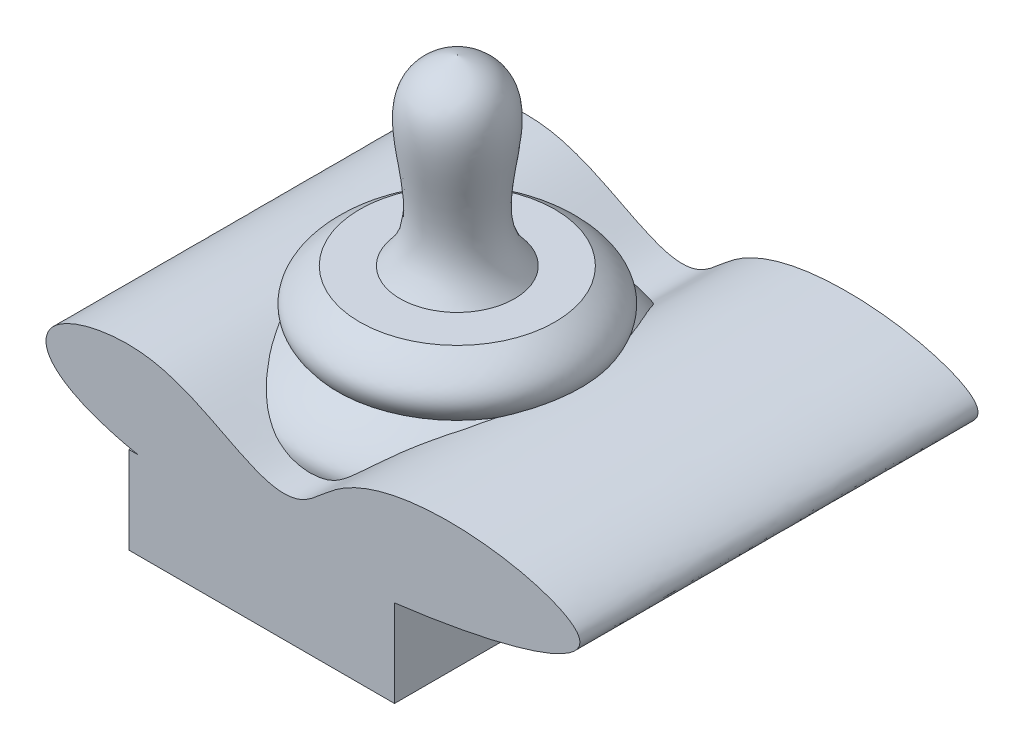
SolidWorks part; units mm, degrees
ref_plane "Front Plane" through (0, 0, 0) normal (0, 0, 1) x (1, 0, 0)
ref_plane "Top Plane" through (0, 0, 0) normal (0, 1, 0) x (1, 0, 0)
ref_plane "Right Plane" through (0, 0, 0) normal (1, 0, 0) x (0, 0, -1)
sketch "Sketch1" plane through (0, 0, 0) normal (0, 0, 1) x (1, 0, 0)
  line L0 (0, 0) -> (0, -54.3886) construction
  line L1 (0, 0) -> (31.766, 0)
  line L2 (0, 0) -> (0, -54.3886)
  spline S0 degree 3 poles (31.766, 0) (55.0699, -14.2399) (21.5753, -21.9397) (12.8614, -50.5304) (21.5731, -74.2423) (0, -54.3886) knots 0 0 0 0 0.481937 0.627515 1 1 1 1
revolve "Revolve1" add sketch "Sketch1" about L0
sketch "Sketch2" plane through (0, 0, 0) normal (0, 0, 1) x (1, 0, 0)
  line L0 (0, -46.5393) -> (0, 59.3095) construction
  line L1 (0, -46.5393) -> (27.7373, -46.5393)
  line L2 (0, -46.5393) -> (0, 59.3095)
  spline S0 degree 3 poles (27.7373, -46.5393) (83.9406, -25.5091) (-21.0612, -11.1362) (27.6229, 52.6904) (0, 59.3095) knots 0 0 0 0 0.579051 1 1 1 1
revolve "Revolve2" add sketch "Sketch2" about L0
sketch "Sketch4" plane through (0, 0, 0) normal (0, 0, 1) x (1, 0, 0)
  line L1 (-42.8346, -44.2544) -> (-45.8577, -44.2544)
  line L2 (40.5249, -44.2544) -> (40.5249, -72.6163)
  line L3 (40.5249, -72.6163) -> (-45.8577, -72.6163)
  line L4 (-45.8577, -44.2544) -> (-45.8577, -72.6163)
  spline S0 degree 3 poles (-42.8346, -44.2544) (-60.6892, -40.7626) (-76.3896, -32.699) (-69.1515, -17.6357) (-27.4241, -7.6255) (1.9974, -41.8242) (36.7445, -3.7084) (138.3026, -22.1063) (76.2243, -39.7793) (40.5249, -44.2544) knots 0 0 0 0 0.119188 0.14197 0.22782 0.379371 0.416905 0.640858 0.842324 0.842324 0.842324 0.842324
  spline S1 degree 3 poles (-31.766, 0) (-42.7337, -6.7018) (-42.8417, -11.5594) (-38.9242, -16.0703) knots 0 0 0 0 0.226818 0.226818 0.226818 0.226818 construction
  spline S2 degree 3 poles (-31.766, 0) (-42.7337, -6.7018) (-42.8417, -11.5594) (-38.9242, -16.0703) knots 0 0 0 0 0.226818 0.226818 0.226818 0.226818 construction
  spline S3 degree 3 poles (-31.766, 0) (-42.7337, -6.7018) (-42.8417, -11.5594) (-38.9242, -16.0703) knots 0 0 0 0 0.226818 0.226818 0.226818 0.226818 construction
  spline S4 degree 3 poles (-31.766, 0) (-42.7337, -6.7018) (-42.8417, -11.5594) (-38.9242, -16.0703) knots 0 0 0 0 0.226818 0.226818 0.226818 0.226818 construction
extrude "Boss-Extrude2" add sketch "Sketch4" along normal blind 0 and the other way blind 68.58 separate body
